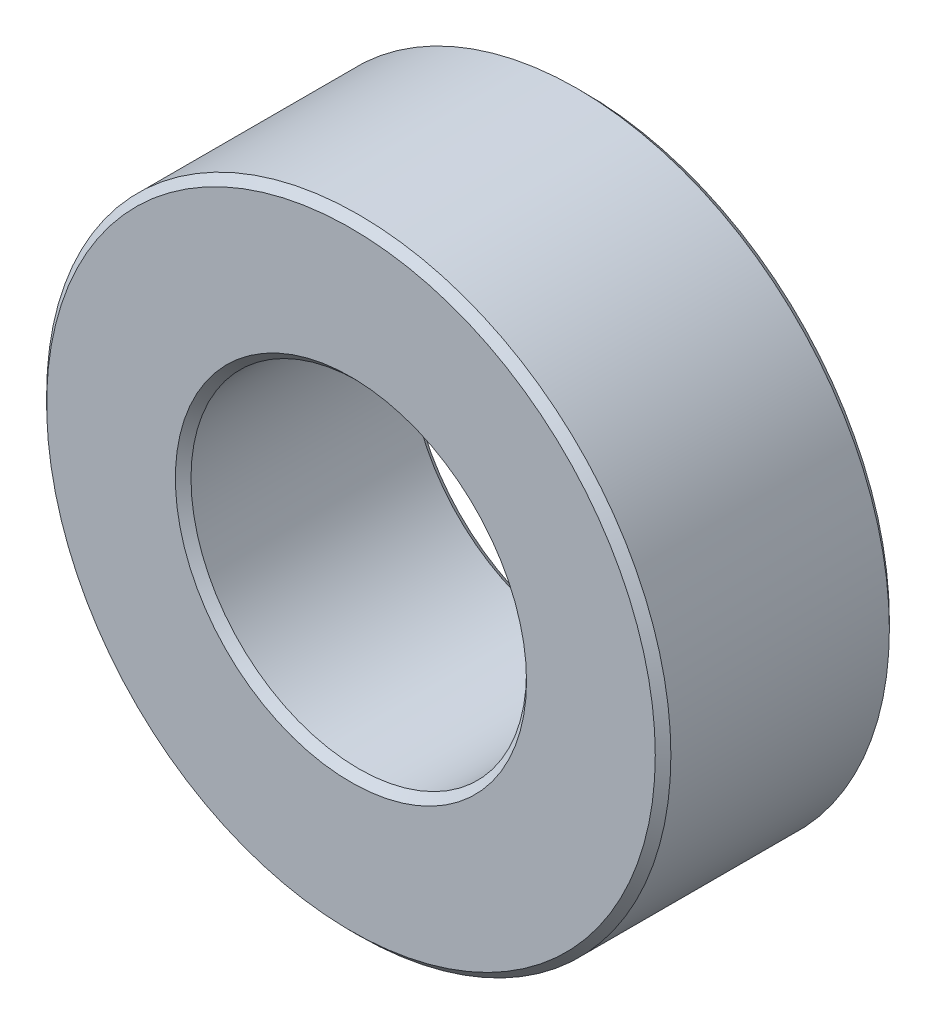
SolidWorks part; units mm, degrees
ref_plane "Front Plane" through (0, 0, 0) normal (0, 0, 1) x (1, 0, 0)
ref_plane "Top Plane" through (0, 0, 0) normal (0, 1, 0) x (1, 0, 0)
ref_plane "Right Plane" through (0, 0, 0) normal (1, 0, 0) x (0, 0, -1)
sketch "Sketch1" plane through (0, 0, 0) normal (0, 0, 1) x (1, 0, 0)
  circle A0 centre (0, 0) radius 4
  circle A1 centre (0, 0) radius 2.15
  dimension "D1" = 8
  dimension "D2" = 4.3
extrude "Boss-Extrude2" add sketch "Sketch1" along normal mid plane 3
chamfer "Chamfer3" distance 0.1 angle 45 4 edges at (4, 0, 1.5) (4, 0, -1.5) (2.15, 0, -1.5) (2.15, 0, 1.5)
